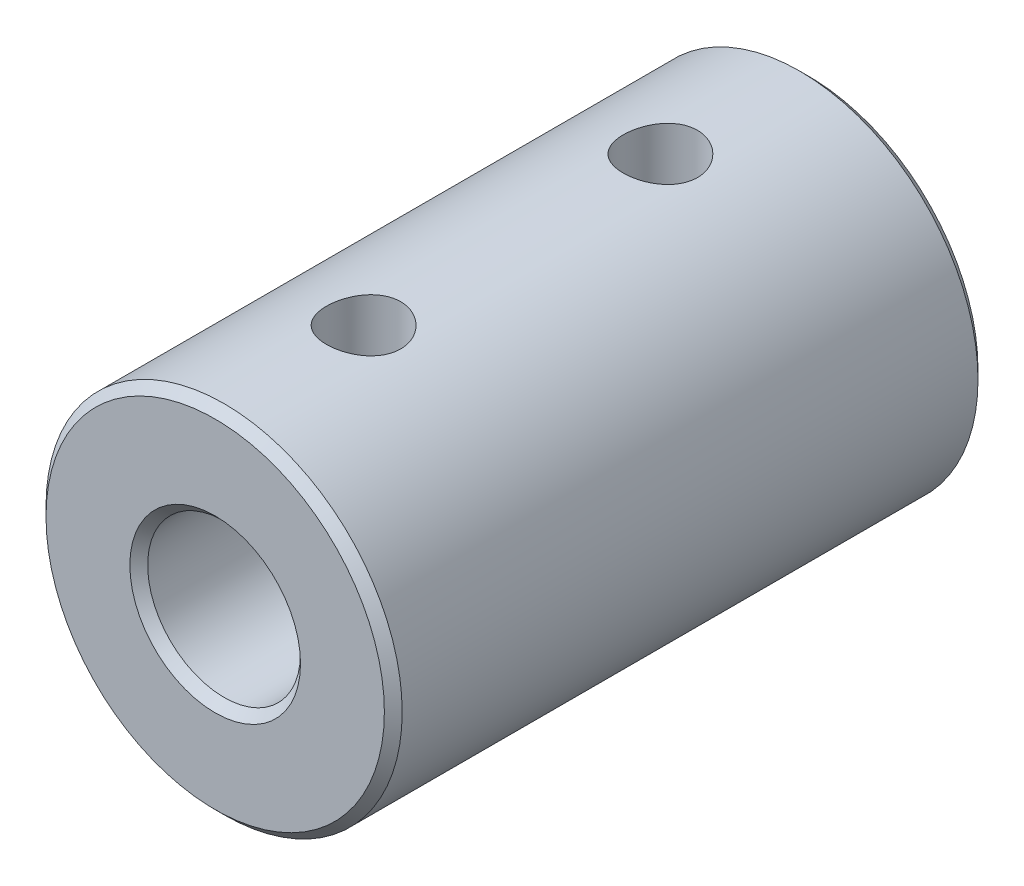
SolidWorks part; units mm, degrees
ref_plane "Plan de face" through (0, 0, 0) normal (0, 0, 1) x (1, 0, 0)
ref_plane "Plan de dessus" through (0, 0, 0) normal (0, 1, 0) x (1, 0, 0)
ref_plane "Plan de droite" through (0, 0, 0) normal (1, 0, 0) x (0, 0, -1)
sketch "Esquisse1" plane through (0, 0, 0) normal (0, 0, 1) x (1, 0, 0)
  circle A0 centre (0, 0) radius 6
  circle A1 centre (0, 0) radius 2.075
extrude "Boss.-Extru.1" add sketch "Esquisse1" along normal mid plane 20
sketch "Esquisse2" plane through (0, 0, 10) normal (0, 0, 1) x (1, 0, 0)
  circle A0 centre (0, 0) radius 2.575
extrude "Enlèv. mat.-Extru.1" cut sketch "Esquisse2" against normal blind 10
ref_plane "Plan1" through (0, 0, 0) normal (0, 1, 0) x (-1, 0, 0)
sketch "Esquisse3" plane through (0, 0, 0) normal (0, 1, 0) x (-1, 0, 0)
  line L0 (0, -2.4446) -> (0, 9.3829) construction
  line L1 (-5.1223, 0) -> (1.4849, 0) construction
  line L2 (-5.1223, 5) -> (1.4849, 5) construction
  circle A0 centre (0, 5) radius 1.25
  circle A1 centre (0, -5) radius 1.25
  dimension "D1" = 5
extrude "Enlèv. mat.-Extru.2" cut sketch "Esquisse3" against normal mid plane 12
chamfer "Chanfrein1" distance 0.3 angle 45 4 edges at (6, 0, -10) (2.075, 0, -10) (2.575, 0, 10) (6, 0, 10)
